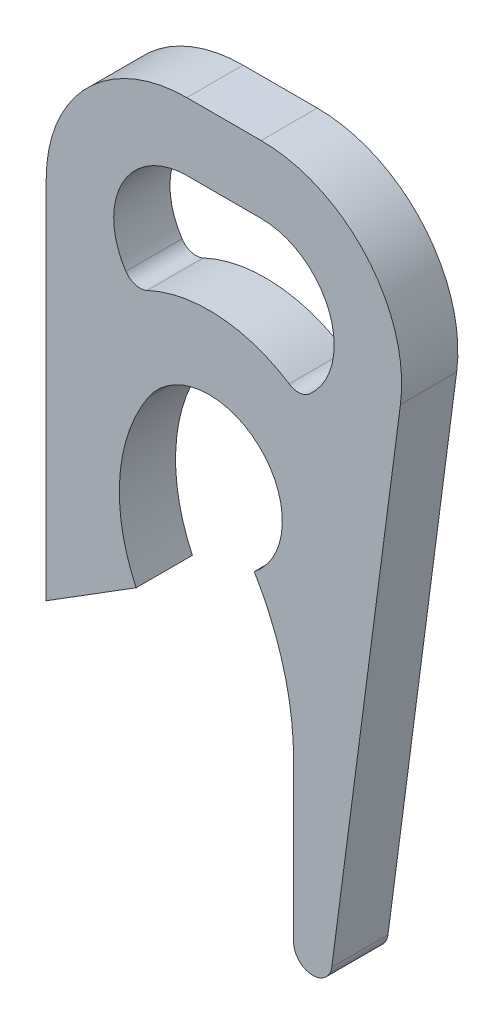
SolidWorks part; units mm, degrees
ref_plane "Plan de face" through (0, 0, 0) normal (0, 0, 1) x (1, 0, 0)
ref_plane "Plan de dessus" through (0, 0, 0) normal (0, 1, 0) x (1, 0, 0)
ref_plane "Plan de droite" through (0, 0, 0) normal (1, 0, 0) x (0, 0, -1)
sketch "Esquisse1" plane through (0, 0, 0) normal (0, 0, 1) x (1, 0, 0)
  line L0 (0, 0) -> (0, 32.5)
  line L1 (12.5, 45) -> (19.1069, 45)
  line L3 (22, -15.2962) -> (22, -1.2574)
  line L4 (8, 5) -> (0, 0)
  line L5 (31.5, 30.8684) -> (25.393, -15.5186)
  arc A0 (0, 32.5) -> (12.5, 45) centre (12.5, 32.5) cw
  arc A1 (19.1069, 45) -> (31.5, 30.8684) centre (19.1069, 32.5) cw
  arc A2 (22, -15.2962) -> (25.393, -15.5186) centre (23.7038, -15.2962) ccw
  arc A3 (22, -1.2574) -> (18.5, 11.5) centre (-3, -1.2574) ccw
  arc A4 (18.5, 11.5) -> (9.075, 20.2074) centre (14.4952, 16.6197) ccw
  arc A5 (9.075, 20.2074) -> (8, 5) centre (22, 11.6521) ccw
  dimension "D2" = 12.5
  dimension "D3" = 12.5
  dimension "D5" = 15.5
  dimension "D6" = 6.5
  dimension "D7" = 25
  dimension "D11" = 22
  dimension "D13" = 60.2962
  dimension "D1" = 31.5
  dimension "D4" = 8
  dimension "D8" = 45
  dimension "D9" = 40
  dimension "D10" = 33.5
  dimension "D12" = 3.5
extrude "Boss.-Extru.1" add sketch "Esquisse1" along normal blind 5
sketch "Esquisse2" plane through (0, 0, 5) normal (0, 0, 1) x (1, 0, 0)
  line L0 (12.5, 39) -> (19.1069, 39)
  line L1 (19.1069, 45) -> (12.5, 45) construction
  arc A0 (8.9666, 28.3855) -> (21.6044, 27.5035) centre (14.4952, 16.6197) cw
  arc A1 (8.9666, 28.3855) -> (7.0773, 28.9161) centre (8.3287, 29.7431) cw
  arc A2 (21.6044, 27.5035) -> (23.4201, 27.6372) centre (22.4247, 28.7594) ccw
  arc A3 (7.0773, 28.9161) -> (12.5, 39) centre (12.5, 32.5) cw
  arc A4 (23.4201, 27.6372) -> (19.1069, 39) centre (19.1069, 32.5) ccw
  arc A5 (18.5, 11.5) -> (9.075, 20.2074) centre (14.4952, 16.6197) ccw construction
  dimension "D2" = 13
  dimension "D3" = 6.5
  dimension "D4" = 1.5
  dimension "D5" = 1.5
  dimension "D6" = 6.5
  dimension "D1" = 6
  dimension "D7" = 0
  dimension "D8" = 0
extrude "Enlèv. mat.-Extru.1" cut sketch "Esquisse2" against normal through all
